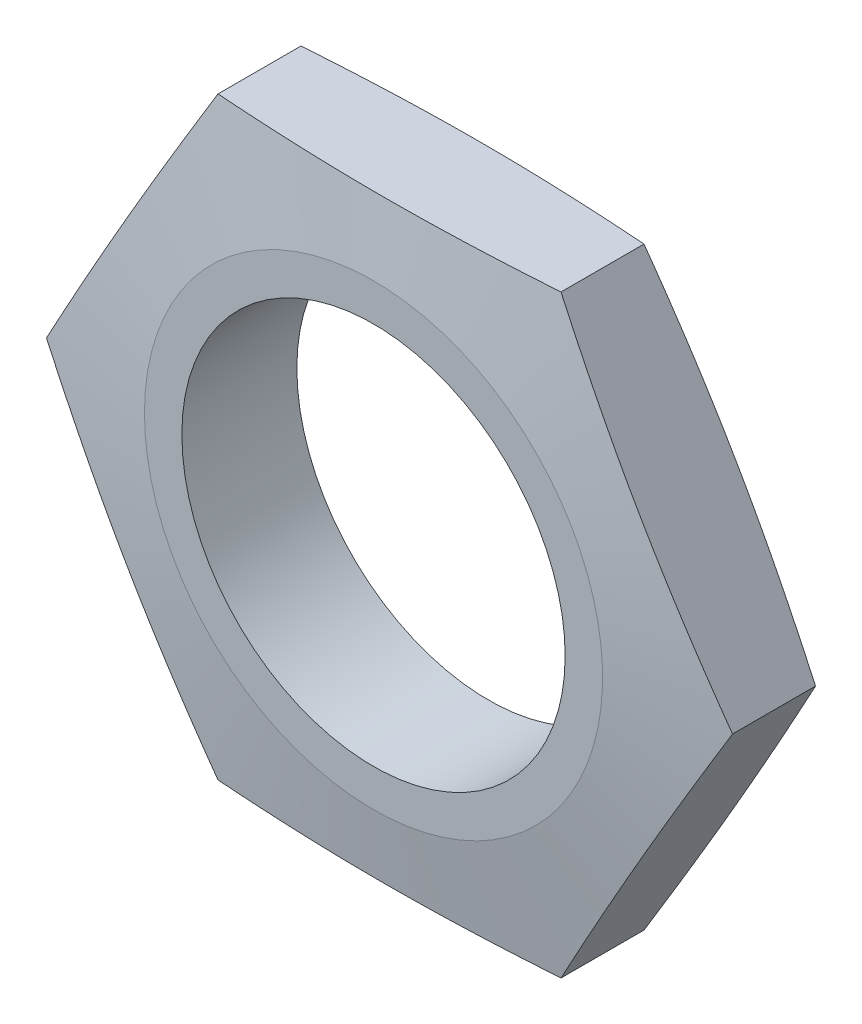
SolidWorks part; units mm, degrees
ref_plane "Front" through (0, 0, 0) normal (0, 0, 1) x (1, 0, 0)
ref_plane "Top" through (0, 0, 0) normal (0, 1, 0) x (1, 0, 0)
ref_plane "Right" through (0, 0, 0) normal (1, 0, 0) x (0, 0, -1)
sketch "Sketch2" plane through (0, 0, 0) normal (0, 0, 1) x (1, 0, 0)
  line L1 (6.8191, -11.811) -> (13.6382, 0)
  line L2 (13.6382, 0) -> (6.8191, 11.811)
  line L3 (6.8191, 11.811) -> (-6.8191, 11.811)
  line L4 (-6.8191, 11.811) -> (-13.6382, 0)
  line L5 (-13.6382, 0) -> (-6.8191, -11.811)
  line L6 (-6.8191, -11.811) -> (6.8191, -11.811)
  circle A0 centre (0, 0) radius 7.62
  circle A1 centre (0, 0) radius 11.811 construction
  dimension "缸径" = 15.24
  dimension "螺母大径" = 23.622
extrude "Base-Extrude" add sketch "Sketch2" along normal mid plane 4.572
sketch "Sketch4" plane through (0, 0, 0) normal (0, 1, 0) x (1, 0, 0)
  line L0 (0, 3.558) -> (0, -4.5381) construction
  line L1 (0, -2.286) -> (0, 2.286) construction
  line L2 (8.9057, 0) -> (2.7758, 0) construction
  line L3 (9.1074, 2.286) -> (13.6382, 1.6496)
  line L4 (13.6382, 2.286) -> (6.8191, 2.286) construction
  line L5 (13.6382, -2.286) -> (13.6382, 2.286) construction
  line L6 (9.1074, -2.286) -> (13.6382, -1.6496)
  line L7 (13.6382, 1.6496) -> (13.6382, 2.286)
  line L8 (13.6382, -1.6496) -> (13.6382, -2.286)
  line L9 (13.6382, 2.286) -> (9.1074, 2.286)
  line L10 (13.6382, -2.286) -> (9.1074, -2.286)
revolve "Cut-Revolve1" cut sketch "Sketch4" angle 360 about L0
